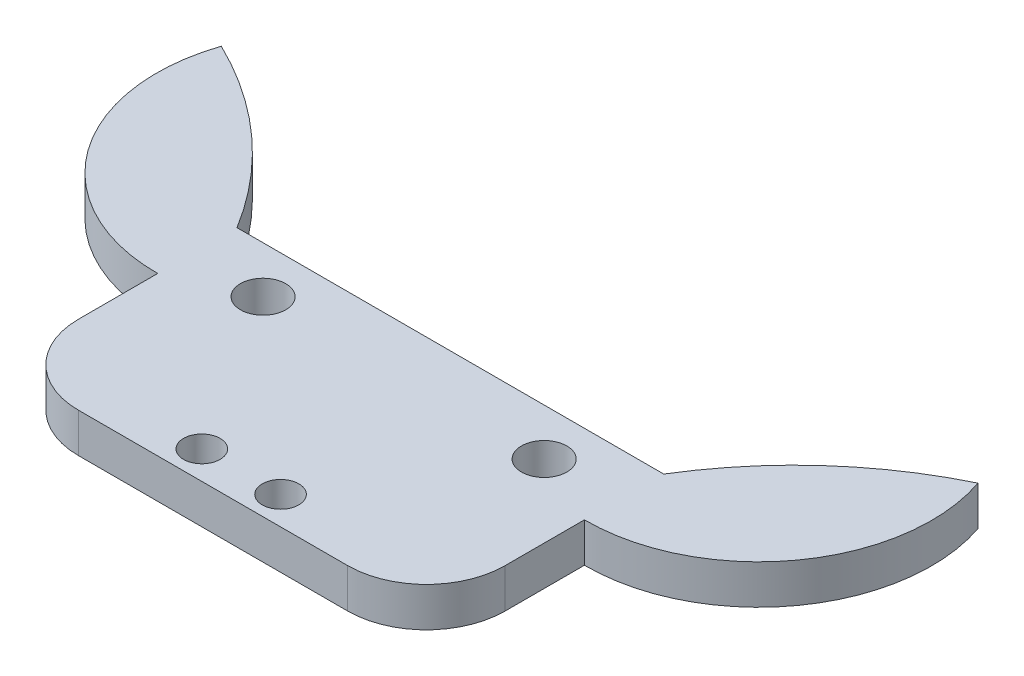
SolidWorks part; units mm, degrees
ref_plane "Front Plane" through (0, 0, 0) normal (0, 0, 1) x (1, 0, 0)
ref_plane "Top Plane" through (0, 0, 0) normal (0, 1, 0) x (1, 0, 0)
ref_plane "Right Plane" through (0, 0, 0) normal (1, 0, 0) x (0, 0, -1)
sketch "Sketch1" plane through (0, 0, 0) normal (0, 1, 0) x (1, 0, 0)
  line L0 (0, -15) -> (0, 35) construction
  line L1 (-17.2093, 34.996) -> (-17.2093, 28.6)
  line L2 (17.2093, 28.6) -> (17.2093, 34.996)
  line L3 (-17.2093, 41.3921) -> (17.2093, 41.3921)
  line L4 (-10.8593, 22.25) -> (10.8593, 22.25)
  circle A1 centre (-3.175, 24.5204) radius 1.4732
  circle A2 centre (3.175, 24.5204) radius 1.4732
  arc A3 (-17.2093, 28.6) -> (-10.8593, 22.25) centre (-10.8593, 28.6) ccw
  arc A4 (10.8593, 22.25) -> (17.2093, 28.6) centre (10.8593, 28.6) ccw
  circle A5 centre (-11.3356, 37.6203) radius 1.8288
  circle A6 centre (11.3356, 37.6203) radius 1.8288
  arc A7 (30.5175, 53.432) -> (17.2093, 34.996) centre (17.3017, 48.9507) cw
  arc A8 (30.5175, 53.432) -> (17.2093, 41.3921) centre (44.3873, 24.7262) ccw
  arc A9 (-30.5175, 53.432) -> (-17.2093, 41.3921) centre (-44.3873, 24.7262) cw
  arc A10 (-30.5175, 53.432) -> (-17.2093, 34.996) centre (-17.3017, 48.9507) ccw
  point P0 (0, 0)
  dimension "D1" = 6.35
  dimension "D2" = 12.7921
extrude "Extrude1" add sketch "Sketch1" along normal blind 3.175
